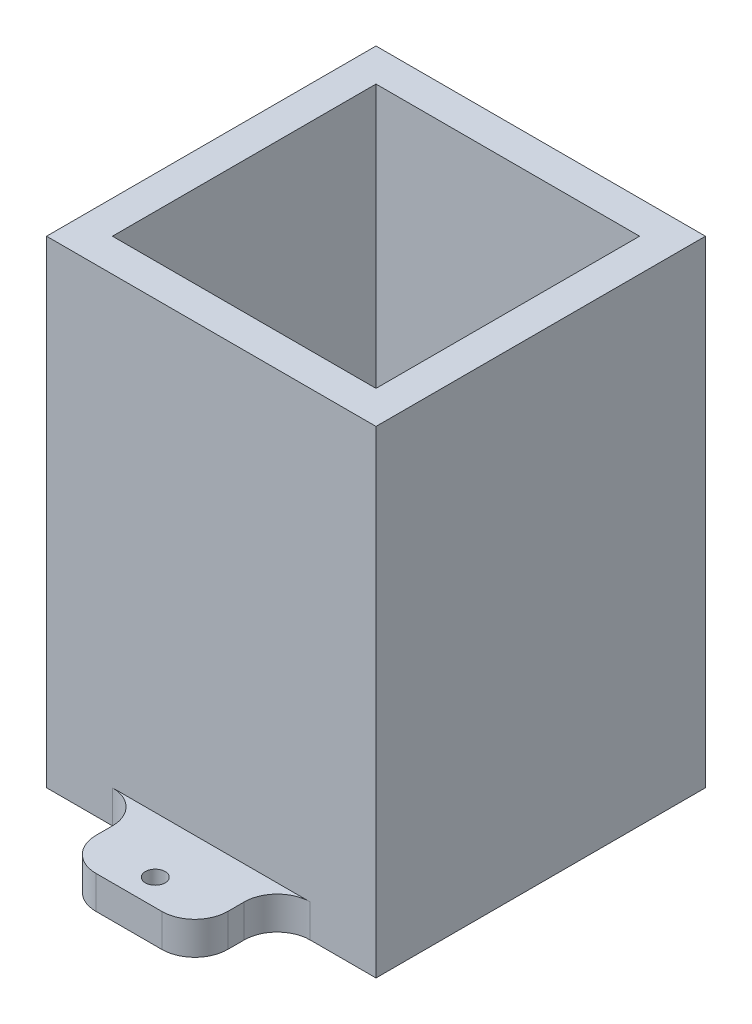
SolidWorks part; units mm, degrees
ref_plane "Front Plane" through (0, 0, 0) normal (0, 0, 1) x (1, 0, 0)
ref_plane "Top Plane" through (0, 0, 0) normal (0, 1, 0) x (1, 0, 0)
ref_plane "Right Plane" through (0, 0, 0) normal (1, 0, 0) x (0, 0, -1)
sketch "Sketch1" plane through (0, 0, 0) normal (0, 1, 0) x (1, 0, 0)
  line L0 (-40, 40) -> (40, 40)
  line L1 (-50, -50) -> (50, -50)
  line L2 (-50, -50) -> (-50, 50)
  line L3 (-50, 50) -> (50, 50)
  line L4 (50, -50) -> (50, 50)
  line L5 (-50, -50) -> (50, 50) construction
  line L6 (-50, 50) -> (50, -50) construction
  line L7 (40, -40) -> (40, 40)
  line L8 (-40, -40) -> (40, -40)
  line L9 (-40, -40) -> (-40, 40)
  point P0 (0, 0)
  dimension "D1" = 100
  dimension "D2" = 10
extrude "Boss-Extrude1" add sketch "Sketch1" along normal blind 140
sketch "Sketch2" plane through (0, 0, 0) normal (0, -1, 0) x (1, 0, 0)
  line L1 (-50, -50) -> (50, -50)
  line L2 (-50, -50) -> (-50, 50)
  line L3 (-50, 50) -> (50, 50)
  line L4 (50, -50) -> (50, 50)
  circle A0 centre (0, 0) radius 25
  dimension "D1" = 50
extrude "Boss-Extrude2" add sketch "Sketch2" along normal blind 5
sketch "Sketch3" plane through (0, -5, 0) normal (0, -1, 0) x (1, 0, 0)
  line L0 (50, 50) -> (-50, 50) construction
  line L1 (-20, 50) -> (20, 50)
  line L2 (-20, 50) -> (-20, 75)
  line L3 (-20, 75) -> (20, 75)
  line L4 (20, 50) -> (20, 75)
  line L5 (0, 50) -> (0, -50) construction
  line L7 (-50, -50) -> (50, -50) construction
  line L8 (-50, 0) -> (50, 0) construction
  line L9 (-50, 50) -> (-50, -50) construction
  line L10 (50, -50) -> (50, 50) construction
  line L11 (20, -50) -> (20, -75)
  line L12 (-20, -75) -> (20, -75)
  line L13 (-20, -50) -> (-20, -75)
  line L14 (-20, -50) -> (20, -50)
  dimension "D1" = 40
  dimension "D2" = 25
extrude "Boss-Extrude3" add sketch "Sketch3" against normal blind 10
sketch "Sketch4" plane through (0, 5, 0) normal (0, 1, 0) x (1, 0, 0)
  line L0 (-20, 67) -> (20, 67) construction
  line L3 (-50, 0) -> (50, 0) construction
  line L4 (-50, 50) -> (-50, -50) construction
  line L5 (50, -50) -> (50, 50) construction
  line L6 (-20, 75) -> (20, 75) construction
  circle A0 centre (0, 67) radius 3
  circle A1 centre (0, -67) radius 3
  dimension "D1" = 6
  dimension "D2" = 8
extrude "Cut-Extrude1" cut sketch "Sketch4" against normal blind 10
fillet "Fillet1" radius 10 8 edges at (-20, 0, -50) (20, 0, -50) (-20, 0, -75) (20, 0, -75) (20, 0, 50) (-20, 0, 50) (20, 0, 75) (-20, 0, 75)
